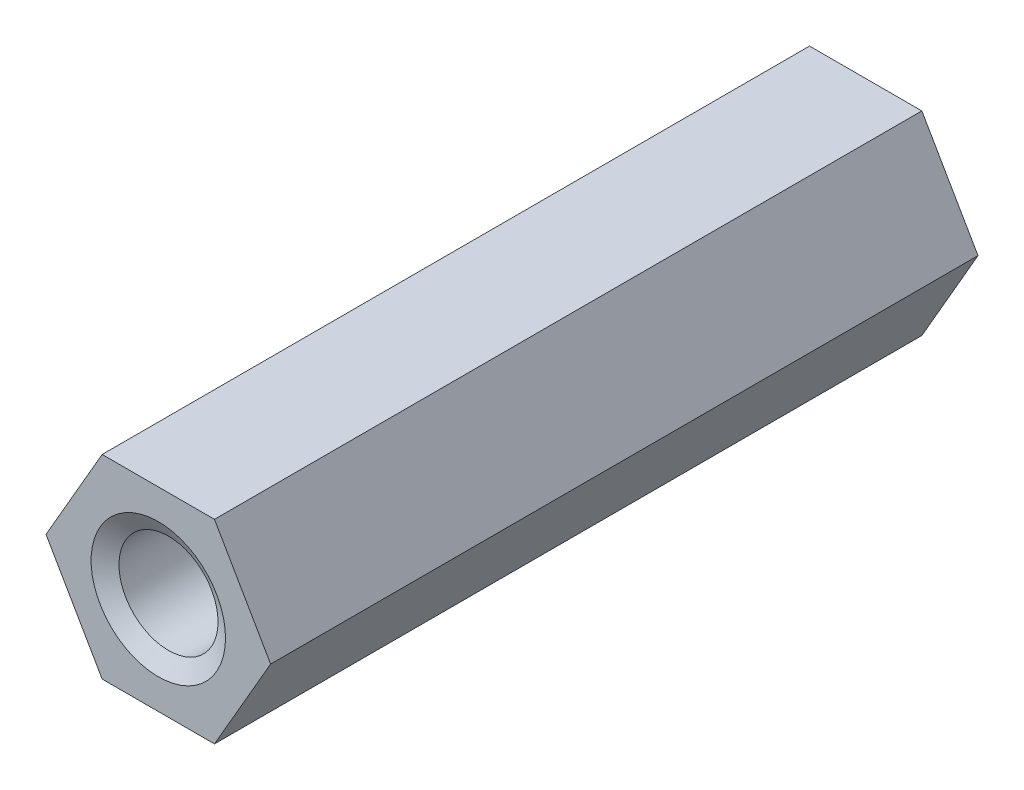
SolidWorks part; units mm, degrees
ref_plane "Front Plane" through (0, 0, 0) normal (0, 0, 1) x (1, 0, 0)
ref_plane "Top Plane" through (0, 0, 0) normal (0, 1, 0) x (1, 0, 0)
ref_plane "Right Plane" through (0, 0, 0) normal (1, 0, 0) x (0, 0, -1)
sketch "Sketch1" plane through (0, 0, 0) normal (0, 0, 1) x (1, 0, 0)
  line L1 (1.5877, 2.75) -> (-1.5877, 2.75)
  line L2 (-1.5877, 2.75) -> (-3.1754, 0)
  line L3 (-3.1754, 0) -> (-1.5877, -2.75)
  line L4 (-1.5877, -2.75) -> (1.5877, -2.75)
  line L5 (1.5877, -2.75) -> (3.1754, 0)
  line L6 (3.1754, 0) -> (1.5877, 2.75)
  circle A0 centre (0, 0) radius 2.75 construction
  dimension "D1" = 5.5
extrude "Boss-Extrude1" add sketch "Sketch1" along normal mid plane 20
sketch "Sketch3" plane through (0, 0, 10) normal (0, 0, 1) x (1, 0, 0)
  circle A0 centre (0, 0) radius 1.4
  dimension "D1" = 2.8
extrude "Cut-Extrude1" cut sketch "Sketch3" against normal blind 6
mirror "Mirror3" about plane through (0, 0, 0) normal (0, 0, 1) of "Cut-Extrude1"
chamfer "Chamfer2" distance 1.2 angle 30 1 edges at (1.4, 0, 4)
chamfer "Chamfer3" distance 0.5 angle 30 2 edges at (1.4, 0, 10) (1.4, 0, -10)
